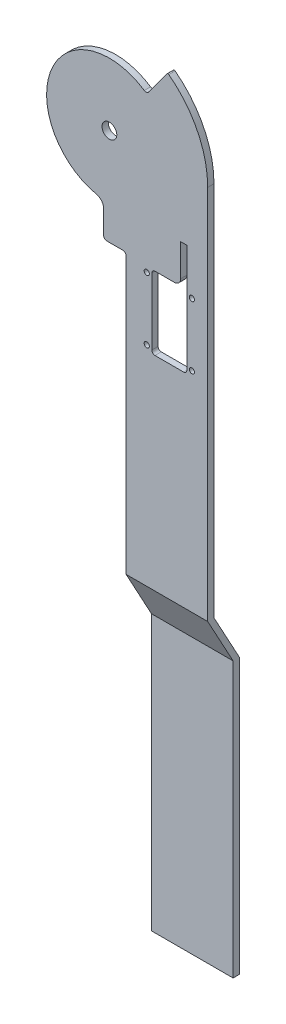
SolidWorks part; units mm, degrees
ref_plane "Front Plane" through (0, 0, 0) normal (0, 0, 1) x (1, 0, 0)
ref_plane "Top Plane" through (0, 0, 0) normal (0, 1, 0) x (1, 0, 0)
ref_plane "Right Plane" through (0, 0, 0) normal (1, 0, 0) x (0, 0, -1)
sketch "Sketch1" plane through (0, 0, 0) normal (0, 0, 1) x (1, 0, 0)
  line L0 (0, 25.4) -> (0, 39.7545) construction
  line L1 (0, 0) -> (1.7777, 2.4073)
  line L2 (39.7545, 0) -> (39.7545, -152.0477)
  line L3 (15.8251, 21.4299) -> (23.3121, 31.5685)
  line L4 (-1.0418, -39.1749) -> (5.4933, -39.1749)
  line L5 (-2.3118, -28.5613) -> (-2.3118, -37.9049)
  line L6 (6.7633, -40.4449) -> (6.7633, -152.0477)
  line L7 (6.7633, -152.0477) -> (39.7545, -152.0477)
  line L8 (31.3336, -24.4667) -> (28.8193, -24.4667) construction
  line L9 (28.8193, -24.4667) -> (28.8193, -27.3837) construction
  line L10 (28.8193, -27.3837) -> (28.8193, -24.4667)
  line L11 (28.8193, -24.4667) -> (31.3336, -24.4667)
  line L12 (31.3336, -24.4667) -> (31.3336, -68.2787)
  line L13 (30.0636, -69.5487) -> (18.4197, -69.5487)
  line L14 (17.1497, -68.2787) -> (17.1497, -41.2786)
  line L15 (18.4197, -40.0086) -> (26.2793, -40.0086)
  line L16 (28.8193, -37.4686) -> (28.8193, -27.3837)
  line L17 (28.8193, -27.3797) -> (27.5575, -27.3797)
  line L18 (27.1203, -29.0635) -> (25.8608, -28.9876)
  line L19 (24.2417, -69.5487) -> (24.2417, -36.019) construction
  line L21 (25.3231, -30.6421) -> (24.0704, -30.4906)
  line L22 (23.4342, -32.1098) -> (22.1929, -31.8832)
  line L23 (21.4604, -33.4611) -> (20.2351, -33.1603)
  line L24 (19.409, -34.6913) -> (18.2039, -34.3173)
  line L25 (17.2873, -35.7959) -> (16.1069, -35.3501)
  line L26 (15.1029, -36.7709) -> (13.9515, -36.2549)
  line L27 (12.8639, -37.6127) -> (11.7456, -37.0284)
  line L28 (10.5783, -38.3184) -> (9.4971, -37.6678)
  line L29 (8.2544, -38.8852) -> (7.2143, -38.1709)
  line L30 (5.9006, -39.3113) -> (4.9054, -38.5357) construction
  line L31 (3.5254, -39.5951) -> (2.5787, -38.761) construction
  line L32 (1.1375, -39.7354) -> (0.2426, -38.8459) construction
  line L33 (-1.2545, -39.7319) -> (-2.0943, -38.7902) construction
  line L34 (-3.642, -39.5845) -> (-4.4236, -38.594)
  line L35 (-6.0163, -39.2938) -> (-6.7369, -38.258)
  line L36 (-8.3689, -38.8608) -> (-9.0259, -37.7835)
  line L37 (-10.6911, -38.287) -> (-11.2821, -37.1723)
  line L38 (-12.9746, -37.5747) -> (-13.4975, -36.4264)
  line L39 (-15.2111, -36.7263) -> (-15.664, -35.5486)
  line L40 (-17.3926, -35.7449) -> (-17.7738, -34.5421)
  line L41 (-19.5111, -34.634) -> (-19.8193, -33.4105)
  line L42 (-21.5589, -33.3978) -> (-21.7929, -32.1579)
  line L43 (-23.5286, -32.0406) -> (-23.6877, -30.7889)
  line L44 (-25.4132, -30.5674) -> (-25.4967, -29.3084)
  line L45 (-27.2057, -28.9835) -> (-27.2133, -27.7218)
  line L46 (-28.8998, -27.2947) -> (-28.8315, -26.0348)
  line L47 (-30.4892, -25.507) -> (-30.3452, -24.2535)
  line L48 (-31.9681, -23.627) -> (-31.749, -22.3844)
  line L49 (27.1203, -29.0635) -> (27.5575, -27.3797)
  line L50 (25.3231, -30.6421) -> (25.8608, -28.9876)
  line L51 (23.4342, -32.1098) -> (24.0704, -30.4906)
  line L52 (21.4604, -33.4611) -> (22.1929, -31.8832)
  line L53 (19.409, -34.6913) -> (20.2351, -33.1603)
  line L54 (17.2873, -35.7959) -> (18.2039, -34.3173)
  line L55 (15.1029, -36.7709) -> (16.1069, -35.3501)
  line L56 (12.8639, -37.6127) -> (13.9515, -36.2549)
  line L57 (10.5783, -38.3184) -> (11.7456, -37.0284)
  line L58 (8.2544, -38.8852) -> (9.4971, -37.6678)
  line L59 (5.9006, -39.3113) -> (7.2143, -38.1709) construction
  line L60 (3.5254, -39.5951) -> (4.9054, -38.5357) construction
  line L61 (1.1375, -39.7354) -> (2.5787, -38.761) construction
  line L62 (-1.2545, -39.7319) -> (0.2426, -38.8459) construction
  line L63 (-3.642, -39.5845) -> (-2.0943, -38.7902)
  line L64 (-6.0163, -39.2938) -> (-4.4236, -38.594)
  line L65 (-8.3689, -38.8608) -> (-6.7369, -38.258)
  line L66 (-10.6911, -38.287) -> (-9.0259, -37.7835)
  line L67 (-12.9746, -37.5747) -> (-11.2821, -37.1723)
  line L68 (-15.2111, -36.7263) -> (-13.4975, -36.4264)
  line L69 (-17.3926, -35.7449) -> (-15.664, -35.5486)
  line L70 (-19.5111, -34.634) -> (-17.7738, -34.5421)
  line L71 (-21.5589, -33.3978) -> (-19.8193, -33.4105)
  line L72 (-23.5286, -32.0406) -> (-21.7929, -32.1579)
  line L73 (-25.4132, -30.5674) -> (-23.6877, -30.7889)
  line L74 (-27.2057, -28.9835) -> (-25.4967, -29.3084)
  line L75 (-28.8998, -27.2947) -> (-27.2133, -27.7218)
  line L76 (-30.4892, -25.507) -> (-28.8315, -26.0348)
  line L77 (-31.9681, -23.627) -> (-30.3452, -24.2535)
  line L78 (-33.3314, -21.6614) -> (-31.749, -22.3844)
  line L80 (-3.7197, 30.3774) -> (-3.7197, 39.5801) construction
  line L81 (3.7197, 30.3774) -> (3.7197, 39.5801) construction
  line L85 (23.2589, -152.0477) -> (23.2589, -179.855) construction
  line L86 (-16.5028, 39.7545) -> (16.4883, 39.7545) construction
  line L87 (-16.5028, 36.1673) -> (-16.5028, 75.7042) construction
  line L88 (0, 39.7545) -> (0, 75.7042) construction
  line L89 (-16.5028, 68.1963) -> (0, 68.1963) construction
  arc A0 (14.0986, 21.1279) -> (-5.3233, -24.8359) centre (0, 0) ccw
  circle A1 centre (0, 0) radius 39.7545 construction
  circle A2 centre (0, 0) radius 32.5772 construction
  circle A3 centre (0, 0) radius 2.9925
  arc A4 (24.0278, 31.6715) -> (39.7545, 0) centre (0, 0) cw
  circle A5 centre (11.7683, 30.3774) radius 1.27 construction
  circle A6 centre (17.1497, 27.6977) radius 1.27 construction
  circle A7 centre (21.9471, 24.0749) radius 1.27 construction
  circle A8 centre (25.9972, 19.6322) radius 1.27 construction
  circle A9 centre (29.1619, 14.5209) radius 1.27 construction
  circle A10 centre (31.3336, 8.9152) radius 1.27 construction
  circle A11 centre (32.4383, 3.0058) radius 1.27 construction
  circle A12 centre (32.4383, -3.0058) radius 1.27 construction
  circle A13 centre (31.3336, -8.9152) radius 1.27 construction
  circle A14 centre (29.1619, -14.5209) radius 1.27 construction
  arc A15 (23.3121, 31.5685) -> (24.0278, 31.6715) centre (23.7208, 31.2668) cw
  arc A16 (5.4933, -39.1749) -> (6.7633, -40.4449) centre (5.4933, -40.4449) cw
  arc A17 (-1.0418, -39.1749) -> (-2.3118, -37.9049) centre (-1.0418, -37.9049) cw
  arc A18 (-2.3118, -28.5613) -> (-5.3233, -24.8359) centre (-6.1218, -28.5613) ccw
  arc A19 (14.0986, 21.1279) -> (15.8251, 21.4299) centre (14.8035, 22.1843) ccw
  arc A20 (-3.7197, 30.3774) -> (3.7197, 30.3774) centre (0, 30.3774) ccw construction
  circle A21 centre (15.1029, -42.0977) radius 1.0427
  circle A22 centre (-11.7683, -30.3774) radius 1.27 construction
  circle A23 centre (-17.1497, -27.6977) radius 1.27 construction
  circle A24 centre (-21.9471, -24.0749) radius 1.27 construction
  circle A25 centre (-25.9972, -19.6322) radius 1.27 construction
  circle A26 centre (-29.1619, -14.5209) radius 1.27 construction
  circle A27 centre (-31.3336, -8.9152) radius 1.27 construction
  circle A28 centre (-32.4383, -3.0058) radius 1.27 construction
  circle A29 centre (-32.4383, 3.0058) radius 1.27 construction
  circle A30 centre (-31.3336, 8.9152) radius 1.27 construction
  circle A31 centre (-29.1619, 14.5209) radius 1.27 construction
  circle A32 centre (-25.9972, 19.6322) radius 1.27 construction
  circle A33 centre (-21.9471, 24.0749) radius 1.27 construction
  circle A34 centre (-17.1497, 27.6977) radius 1.27 construction
  circle A35 centre (-11.7683, 30.3774) radius 1.27 construction
  circle A36 centre (33.3804, -42.0977) radius 1.0427
  circle A37 centre (33.3804, -67.4596) radius 1.0427
  circle A38 centre (15.1029, -67.4596) radius 1.0427
  circle A39 centre (0, 32.5772) radius 2.9925 construction
  circle A40 centre (-8.2514, 57.4535) radius 2.9925 construction
  arc A41 (26.2793, -40.0086) -> (28.8193, -37.4686) centre (26.2793, -37.4686) ccw
  arc A42 (30.0636, -69.5487) -> (31.3336, -68.2787) centre (30.0636, -68.2787) ccw
  arc A43 (18.4197, -69.5487) -> (17.1497, -68.2787) centre (18.4197, -68.2787) cw
  arc A44 (17.1497, -41.2786) -> (18.4197, -40.0086) centre (18.4197, -41.2786) cw
  point P34 (23.6158, 31.9798)
  point P47 (6.7633, -39.1749)
  point P78 (0, 0)
  point P152 (0, 0)
  point P211 (0, 0)
  dimension "D1" = 0.508
  dimension "D2" = 1.27
  dimension "D3" = 3.81
  dimension "D4" = 1.27
  dimension "D5" = 1.27
  dimension "D8" = 2.54
  dimension "D9" = 1.27
  dimension "D6" = 30
  dimension "D7" = 30
extrude "Boss-Extrude4" add sketch "Sketch1" along normal mid plane 2.54
sketch "Sketch3" plane through (39.7545, 0, 0) normal (1, 0, 0) x (0, 0, -1)
  line L0 (-1.27, -152.0477) -> (1.27, -152.0477) construction
  line L1 (-1.27, -152.0477) -> (1.27, -152.0477)
  line L2 (-1.27, -152.0477) -> (9.0092, -170.9865)
  line L3 (1.27, -152.0477) -> (11.5492, -170.9865)
  line L4 (9.0092, -170.9865) -> (9.0092, -282.0709)
  line L5 (11.5492, -170.9865) -> (11.5492, -282.0709)
  line L6 (11.5492, -282.0709) -> (9.0092, -282.0709)
extrude "Boss-Extrude5" add sketch "Sketch3" against normal up to vertex (32.9912 mm away)
